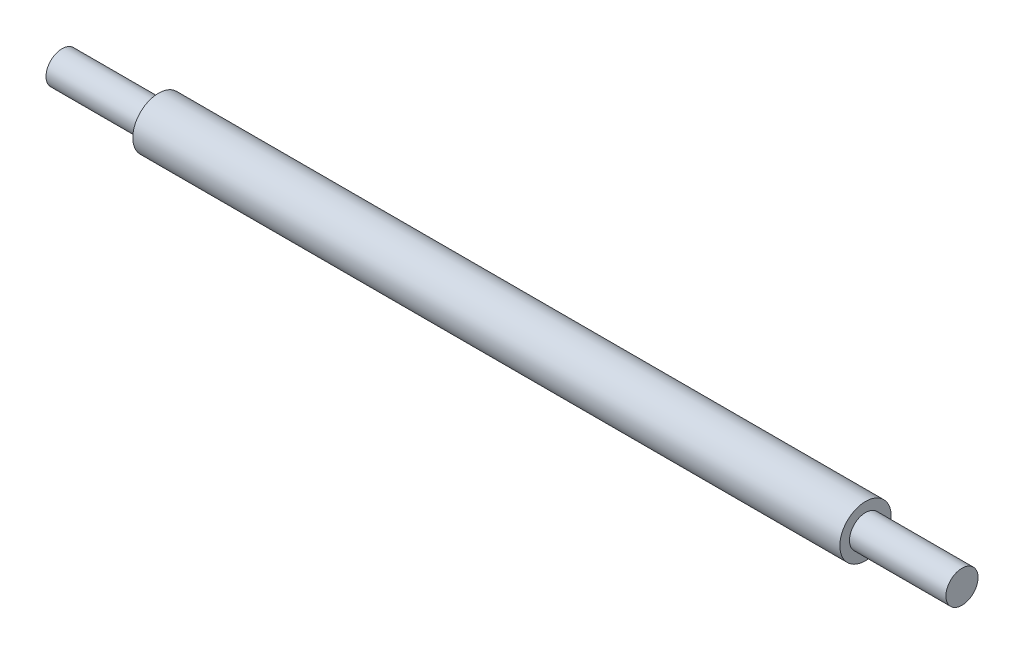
SolidWorks part; units mm, degrees
ref_plane "Front Plane" through (0, 0, 0) normal (0, 0, 1) x (1, 0, 0)
ref_plane "Top Plane" through (0, 0, 0) normal (0, 1, 0) x (1, 0, 0)
ref_plane "Right Plane" through (0, 0, 0) normal (1, 0, 0) x (0, 0, -1)
sketch "Sketch1" plane through (0, 0, 0) normal (0, 0, 1) x (1, 0, 0)
  line L0 (0, 0) -> (88.4482, 0) construction
  line L1 (0, 0) -> (0, 1.5875)
  line L2 (0, 1.5875) -> (9.525, 1.5875)
  line L3 (9.525, 1.5875) -> (9.525, 2.54)
  line L4 (9.525, 2.54) -> (79.375, 2.54)
  line L5 (79.375, 2.54) -> (79.375, 1.5875)
  line L6 (79.375, 1.5875) -> (88.9, 1.5875)
  line L7 (88.9, 1.5875) -> (88.9, 0)
  line L8 (88.9, 0) -> (0, 0)
  dimension "D1" = 3.175
  dimension "D2" = 5.08
  dimension "D3" = 69.85
  dimension "D4" = 9.525
revolve "Revolve1" add sketch "Sketch1" angle 360 about L0
